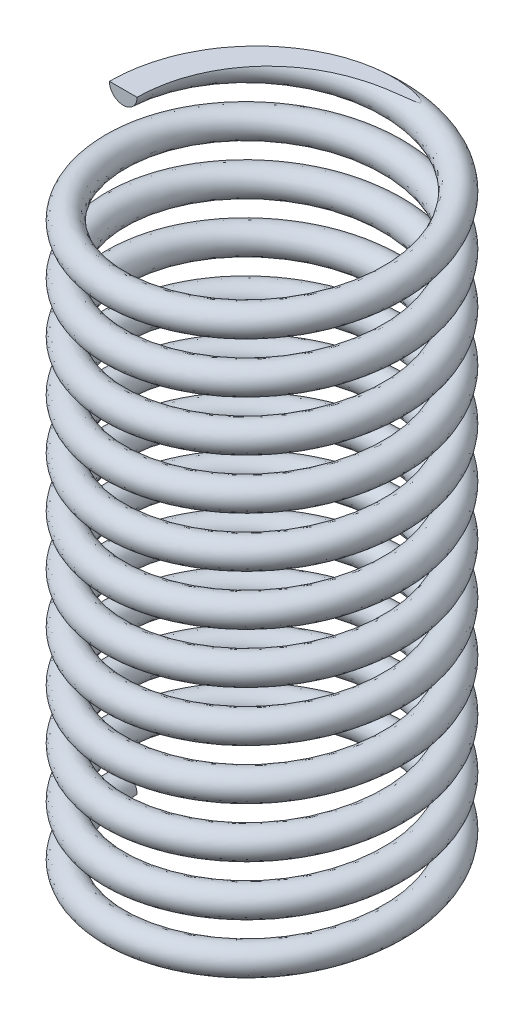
SolidWorks part; units mm, degrees
ref_plane "Front" through (0, 0, 0) normal (0, 0, 1) x (1, 0, 0)
ref_plane "Top" through (0, 0, 0) normal (0, 1, 0) x (1, 0, 0)
ref_plane "Right" through (0, 0, 0) normal (1, 0, 0) x (0, 0, -1)
sketch "Sketch2" plane through (0, 0, 0) normal (0, 0, 1) x (1, 0, 0)
  line L0 (0, 0) -> (0, 10.8767)
  line L1 (0, -50) -> (0, 50) construction
  line L4 (-2.5, 10.8767) -> (2.5, 10.8767) construction
sketch "Sketch3" plane through (0, 0, 0) normal (0, 0, 1) x (1, 0, 0)
  circle A0 centre (-2.5, 0) radius 0.25
  dimension "D1" = 0.5
  dimension "D2" = 2.5
sweep "Sweep1" add profiles "Sketch3" path "Sketch2" parameters "D1"=4320
other "SurfaceCut1"
ref_plane "Plane1" through (0, 10.8767, 0) normal (0, 1, 0) x (1, 0, 0)
other "SurfaceCut2"
